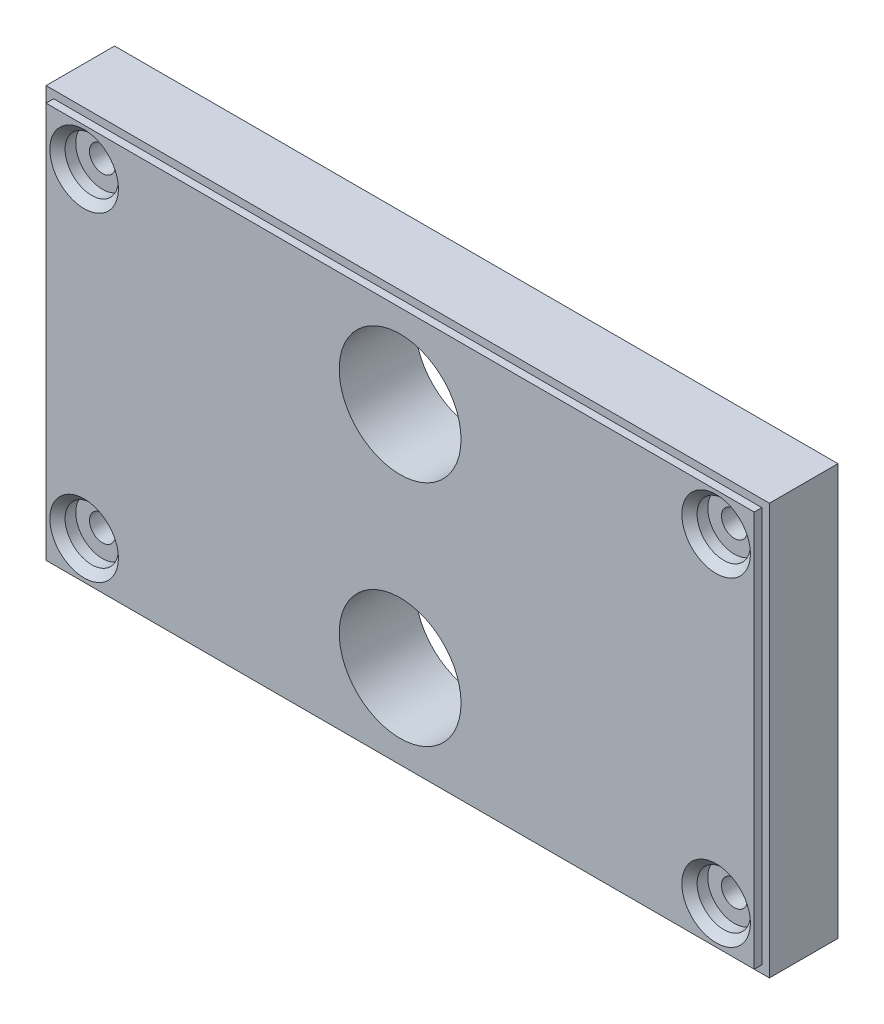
SolidWorks part; units mm, degrees
ref_plane "Front Plane" through (0, 0, 0) normal (0, 0, 1) x (1, 0, 0)
ref_plane "Top Plane" through (0, 0, 0) normal (0, 1, 0) x (1, 0, 0)
ref_plane "Right Plane" through (0, 0, 0) normal (1, 0, 0) x (0, 0, -1)
sketch "Sketch1" plane through (0, 0, 0) normal (0, 0, 1) x (1, 0, 0)
  line L4 (-454.8517, 27) -> (-454.8517, -27)
  line L5 (-454.8517, -27) -> (-359.8517, -27)
  line L6 (-359.8517, -27) -> (-359.8517, 27)
  line L7 (-359.8517, 27) -> (-454.8517, 27)
  line L8 (-454.8517, 27) -> (-454.8517, -27)
  line L9 (-454.8517, -27) -> (-359.8517, -27)
  line L10 (-359.8517, -27) -> (-359.8517, 27)
  line L11 (-359.8517, 27) -> (-454.8517, 27)
  dimension "D1" = 0
extrude "Boss-Extrude1" add sketch "Sketch1" along normal up to surface (10 mm away)
sketch "Sketch2" plane through (0, 0, 10) normal (0, 0, 1) x (1, 0, 0)
  line L0 (-453.8517, 26) -> (-453.8517, -26)
  line L1 (-453.8517, -26) -> (-360.8517, -26)
  line L2 (-360.8517, -26) -> (-360.8517, 26)
  line L3 (-360.8517, 26) -> (-453.8517, 26)
  line L4 (-454.8517, 27) -> (-454.8517, -27)
  line L5 (-454.8517, -27) -> (-359.8517, -27)
  line L6 (-359.8517, -27) -> (-359.8517, 27)
  line L7 (-359.8517, 27) -> (-454.8517, 27)
  line L8 (-454.8517, 27) -> (-454.8517, -27)
  line L9 (-454.8517, -27) -> (-359.8517, -27)
  line L10 (-359.8517, -27) -> (-359.8517, 27)
  line L11 (-359.8517, 27) -> (-454.8517, 27)
  dimension "D1" = 0
  dimension "D2" = 1
extrude "Cut-Extrude1" cut sketch "Sketch2" against normal blind 1
hole_wizard "CBORE for M3 Pan Head Screw1" positions "3DSketch1" profile "Sketch3" counterbore size "M3" standard "ISO"
sketch3d "3DSketch1"
  point P0 (-448.8517, 21, 10)
  point P2 (-365.8517, 21, 10)
  point P4 (-365.8517, -21, 10)
  point P6 (-448.8517, -21, 10)
  dimension "D1" = 6
  dimension "D2" = 6
  dimension "D3" = 6
  dimension "D4" = 6
  dimension "D5" = 6
  dimension "D6" = 6
  dimension "D7" = 6
  dimension "D8" = 6
sketch "Sketch3" plane through (-448.8517, 21, 10) normal (1, 0, 0) x (0, -1, 0)
  line L0 (0, 0) -> (0, 10)
  line L1 (0, 10) -> (1.7, 10)
  line L3 (1.7, 10) -> (1.7, 2.4)
  line L4 (1.7, 2.4) -> (3.5, 2.4)
  line L5 (3.5, 2.4) -> (3.5, 0)
  line L7 (3.5, 0) -> (0, 0)
  line L11 (0, -6.35) -> (0, 107.95) construction
  dimension "Thru Hole Dia." = 3.4
  dimension "Thru Hole Depth" = 10
  dimension "C'Bore Dia." = 7
  dimension "C'Bore Depth" = 2.4
chamfer "Chamfer1" distance 1 angle 45 4 edges at (-362.3517, -21, 10) (-362.3517, 21, 10) (-445.3517, 21, 10) (-445.3517, -21, 10)
sketch "Sketch4" plane through (0, 0, 10) normal (0, 0, 1) x (1, 0, 0)
  line L0 (-454.8517, 0) -> (-359.8517, 0) construction
  line L1 (-454.8517, 27) -> (-454.8517, -27) construction
  line L2 (-359.8517, -27) -> (-359.8517, 27) construction
  line L3 (-407.3517, 27) -> (-407.3517, -27) construction
  line L4 (-359.8517, 27) -> (-454.8517, 27) construction
  line L5 (-454.8517, -27) -> (-359.8517, -27) construction
  circle A0 centre (-407.3517, 15) radius 8
  circle A1 centre (-407.3517, -15) radius 8
  dimension "D2" = 16
  dimension "D3" = 12
  dimension "D4" = 16
  dimension "D1" = 12
extrude "Cut-Extrude2" cut sketch "Sketch4" against normal blind 10
